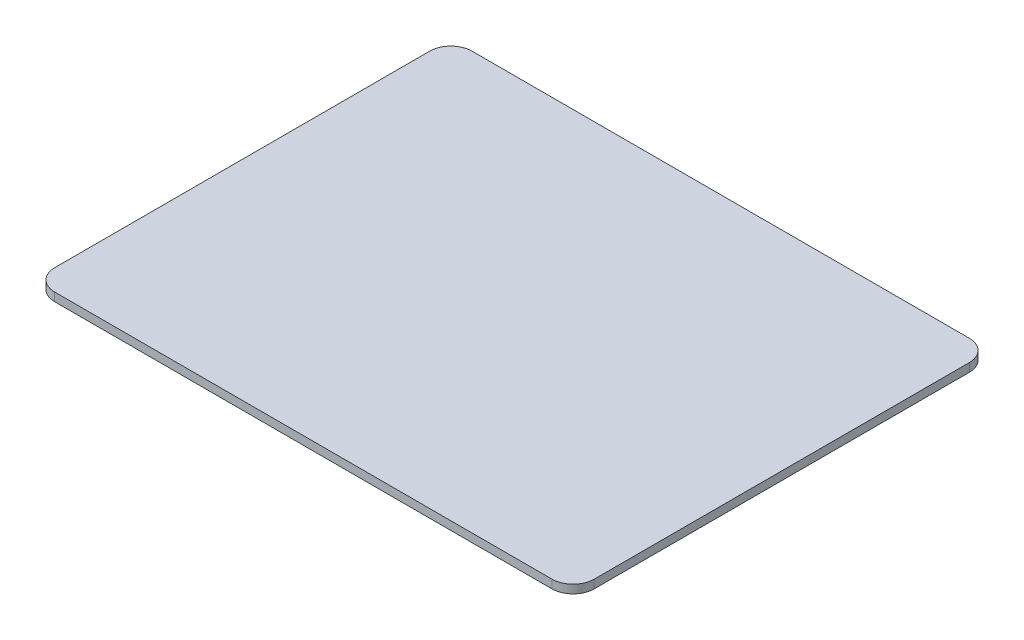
SolidWorks part; units mm, degrees
ref_plane "Plan de face" through (0, 0, 0) normal (0, 0, 1) x (1, 0, 0)
ref_plane "Plan de dessus" through (0, 0, 0) normal (0, 1, 0) x (1, 0, 0)
ref_plane "Plan de droite" through (0, 0, 0) normal (1, 0, 0) x (0, 0, -1)
sketch "Esquisse1" plane through (0, 0, 0) normal (0, 1, 0) x (1, 0, 0)
  line L1 (0, 0) -> (64, 0)
  line L2 (0, 0) -> (0, 49.5)
  line L3 (0, 49.5) -> (64, 49.5)
  line L4 (64, 0) -> (64, 49.5)
  dimension "D1" = 49.5
  dimension "D2" = 64
extrude "Boss.-Extru.1" add sketch "Esquisse1" along normal blind 1
fillet "Congé1" radius 2.5 4 edges at (0, 0.5, -49.5) (64, 0.5, -49.5) (64, 0.5, 0) (0, 0.5, 0)
